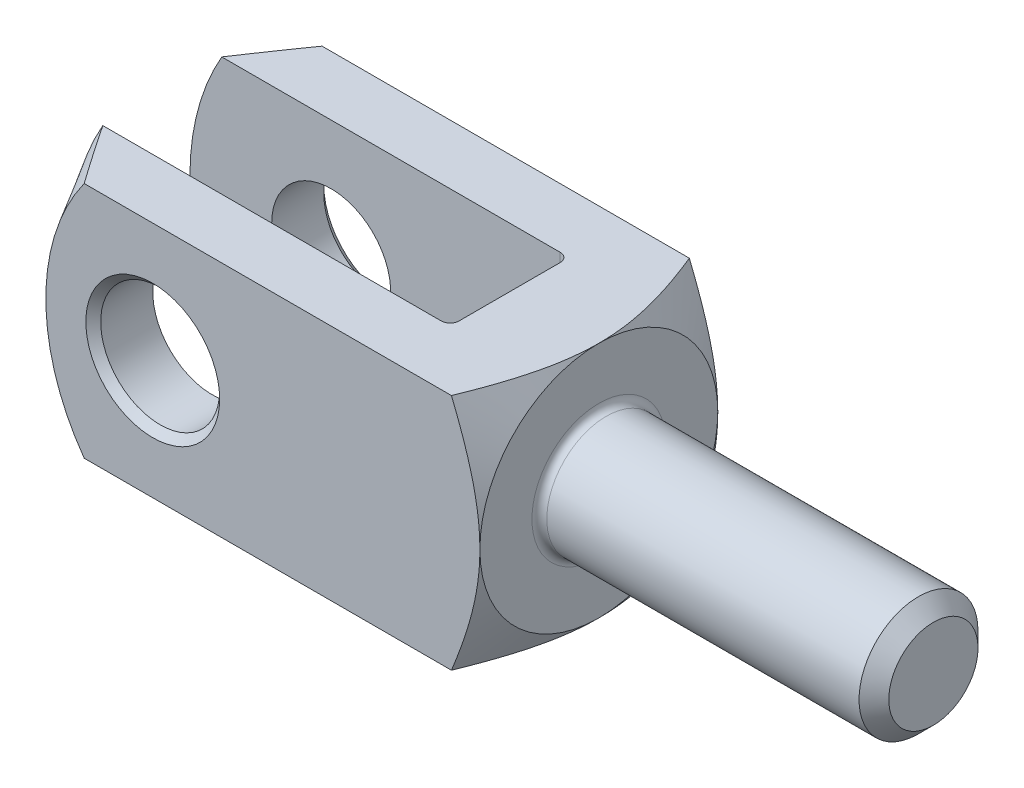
SolidWorks part; units mm, degrees
ref_plane "Front Plane" through (0, 0, 0) normal (0, 0, 1) x (1, 0, 0)
ref_plane "Top Plane" through (0, 0, 0) normal (0, 1, 0) x (1, 0, 0)
ref_plane "Right Plane" through (0, 0, 0) normal (1, 0, 0) x (0, 0, -1)
sketch "Sketch1" plane through (0, 0, 0) normal (1, 0, 0) x (0, 0, -1)
  line L0 (0, 0) -> (0, 50000) construction
  line L1 (0, 0) -> (50000, 0) construction
  line L2 (-16, -16) -> (-16, 16)
  line L3 (-16, 16) -> (16, 16)
  line L4 (16, -16) -> (16, 16)
  line L5 (-16, -16) -> (16, -16)
  point P9 (0, 16)
  point P11 (16, 0)
  point P12 (-16, 0)
  dimension "D1" = 32
  dimension "D2" = 32
extrude "Extrude1" add sketch "Sketch1" against normal blind 108
sketch "Sketch2" plane through (0, 0, 0) normal (1, 0, 0) x (0, 0, -1)
  circle A0 centre (0, 0) radius 8
  circle A1 centre (0, 0) radius 32
  dimension "D1" = 16
  dimension "D2" = 64
extrude "Extrude2" cut sketch "Sketch2" against normal blind 45
sketch "Sketch3" plane through (0, 0, 16) normal (0, 0, 1) x (1, 0, 0)
  circle A0 centre (-89, 0) radius 8
  dimension "D1" = 16
  dimension "D2" = 89
extrude "Extrude3" cut sketch "Sketch3" against normal through all
sketch "Sketch4" plane through (0, 16, 0) normal (0, 1, 0) x (1, 0, 0)
  line L0 (0, 0) -> (-50000, 0) construction
  line L1 (-108, -8) -> (-108, 8)
  line L2 (-108, 16) -> (-108, -16) construction
  line L3 (-108, 8) -> (-57, 8)
  line L4 (-57, 8) -> (-57, -8)
  line L5 (-89, 16) -> (-89, -16) construction
  line L6 (-108, -8) -> (-57, -8)
  point P7 (-89, 0)
  point P13 (-57, 0)
  point P14 (-108, 0)
  dimension "D1" = 32
  dimension "D2" = 16
extrude "Extrude4" cut sketch "Sketch4" against normal through all
fillet "Fillet1" radius 1.2 2 edges at (-57, 0, 8) (-57, 0, -8)
fillet "Fillet2" radius 1 1 edges at (-45, 0, -8)
chamfer "Chamfer2" distance 1 angle 45 2 edges at (-81, 0, -16) (-81, 0, 16)
sketch "Sketch6" plane through (0, 0, 0) normal (0, 0, 1) x (1, 0, 0)
  line L0 (-45, -16) -> (-45, -32)
  line L1 (-45, -32) -> (-54.2376, -32)
  line L2 (-54.2376, -32) -> (-45, -16)
  dimension "D1" = 30
  dimension "D2" = 32
revolve "Cut-Revolve1" cut sketch "Sketch6" angle 360 about axis through (-45, 0, 0) along (1, 0, 0)
sketch "Sketch7" plane through (0, 0, 0) normal (0, 1, 0) x (1, 0, 0)
  line L0 (-103.3812, -16) -> (-108, -8)
  line L1 (-108, 8) -> (-103.3812, 16)
  line L2 (-103.3812, 16) -> (-140, 16)
  line L3 (-108, 8) -> (-108, -8)
  line L4 (-140, 16) -> (-140, -16)
  line L5 (-140, -16) -> (-103.3812, -16)
  line L6 (-108, 16) -> (-48.8263, 16) construction
  line L7 (-108, -16) -> (-48.8263, -16) construction
  line L8 (-76, 0.6162) -> (-76, 50000.6162) construction
  dimension "D1" = 120
  dimension "D2" = 32
  dimension "D3" = 32
revolve "Cut-Revolve2" cut sketch "Sketch7" angle 180 about L8
chamfer "Chamfer3" distance 2 angle 45 1 edges at (0, 0, -8)
equation "\"D2@Sketch1\" = \"D1@Sketch1\""
equation "\"D2@Sketch2\" = \"D1@Sketch1\"/.5"
equation "\"D2@Sketch6\" = \"D1@Sketch1\""
equation "\"D2@Sketch7\" = \"D1@Sketch1\""
equation "\"D3@Sketch7\" = \"D1@Sketch1\""
